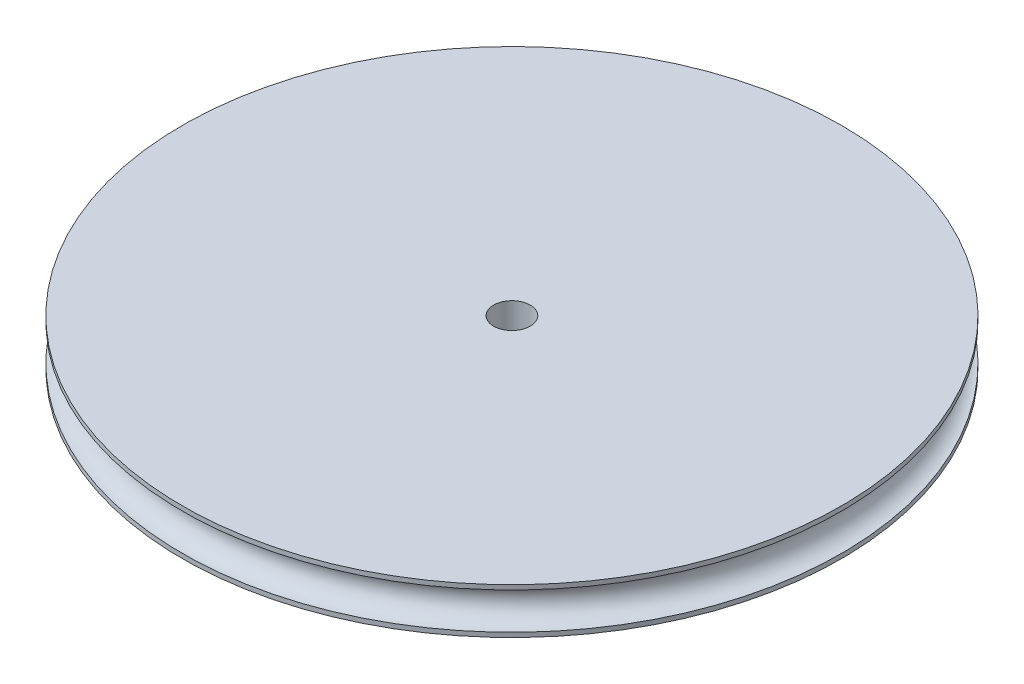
SolidWorks part; units mm, degrees
ref_plane "Front Plane" through (0, 0, 0) normal (0, 0, 1) x (1, 0, 0)
ref_plane "Top Plane" through (0, 0, 0) normal (0, 1, 0) x (1, 0, 0)
ref_plane "Right Plane" through (0, 0, 0) normal (1, 0, 0) x (0, 0, -1)
sketch "Sketch1" plane through (0, 0, 0) normal (0, 0, 1) x (1, 0, 0)
  line L0 (57.15, 7.9375) -> (57.15, 7.1437)
  line L1 (0, 0) -> (57.15, 0)
  line L2 (0, 0) -> (0, 7.9375)
  line L3 (0, 7.9375) -> (57.15, 7.9375)
  line L4 (57.15, 0.7938) -> (57.15, 0)
  line L5 (-2.8697, 3.9688) -> (59.2633, 3.9688) construction
  arc A0 (57.15, 7.1437) -> (57.15, 0.7938) centre (57.15, 3.9688) ccw
  point P10 (0, 3.9688)
  dimension "D1" = 3.175
  dimension "D2" = 7.9375
  dimension "D3" = 57.15
revolve "Revolve1" add sketch "Sketch1" angle 360 about L2
sketch "Sketch2" plane through (0, 7.9375, 0) normal (0, 1, 0) x (1, 0, 0)
  circle A0 centre (0, 0) radius 3.175
  dimension "D1" = 6.35
extrude "Cut-Extrude1" cut sketch "Sketch2" against normal up to next
